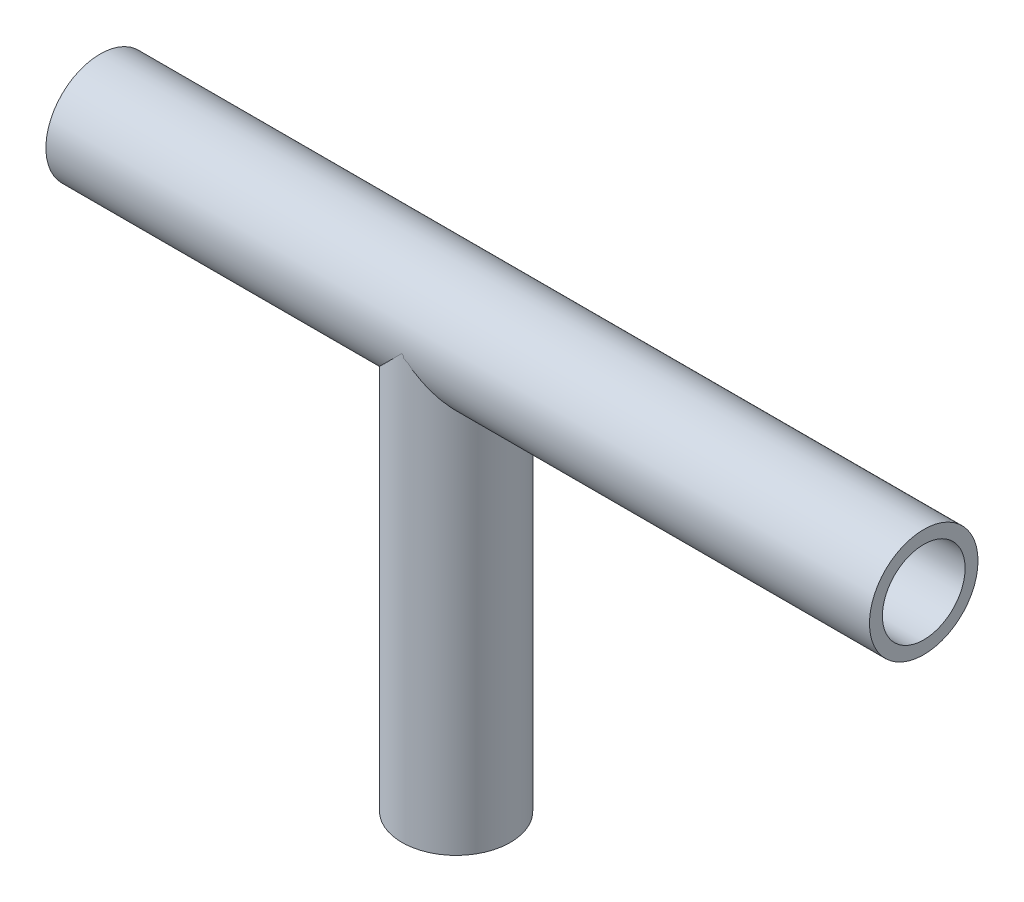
SolidWorks part; units mm, degrees
ref_plane "Ebene vorne" through (0, 0, 0) normal (0, 0, 1) x (1, 0, 0)
ref_plane "Ebene oben" through (0, 0, 0) normal (0, 1, 0) x (1, 0, 0)
ref_plane "Ebene rechts" through (0, 0, 0) normal (1, 0, 0) x (0, 0, -1)
sketch "Skizze1" plane through (0, 0, 0) normal (0, 0, 1) x (1, 0, 0)
  line L0 (-88.2461, 0) -> (115.9095, 0)
sketch "Skizze2" plane through (0, 0, 0) normal (0, 0, 1) x (1, 0, 0)
  line L0 (0, 0) -> (0, -104.9825)
other "Strukturbauteil1"
ref_plane "Ebene1" through (-88.2461, 0, 0) normal (1, 0, 0) x (0, 0, 1)
sketch "Sketch1" plane through (-88.2461, 0, 0) normal (1, 0, 0) x (0, 0, 1)
  circle A0 centre (0, 0) radius 10.25
  circle A1 centre (0, 0) radius 13.45
  point P3 (0, 0)
  dimension "In_dia" = 20.5
  dimension "Out_dia" = 26.9
other "Strukturbauteil2"
ref_plane "Ebene2" through (0, 0, 0) normal (0, -1, 0) x (0, 0, 1)
sketch "Sketch11" plane through (0, 0, 0) normal (0, -1, 0) x (0, 0, 1)
  circle A0 centre (0, 0) radius 10.25
  circle A1 centre (0, 0) radius 13.45
  point P3 (0, 0)
  dimension "In_dia" = 20.5
  dimension "Out_dia" = 26.9
other "Trimmen/Verlängern1"
sketch "Skizze5" plane through (0, -104.9825, 0) normal (0, -1, 0) x (1, 0, 0)
  circle A0 centre (0, 0) radius 10.25 construction
  circle A1 centre (0, 0) radius 10.25
extrude "Schnitt-Linear austragen1" cut sketch "Skizze5" against normal up to vertex
equation "\"LÄNGE\"=0"
equation "\"BREITE\"=0"
equation "\"HÖHE\"=0"
equation "\"DURCHMESSER\"=0"
equation "\"Stückzahl\"= 1"
